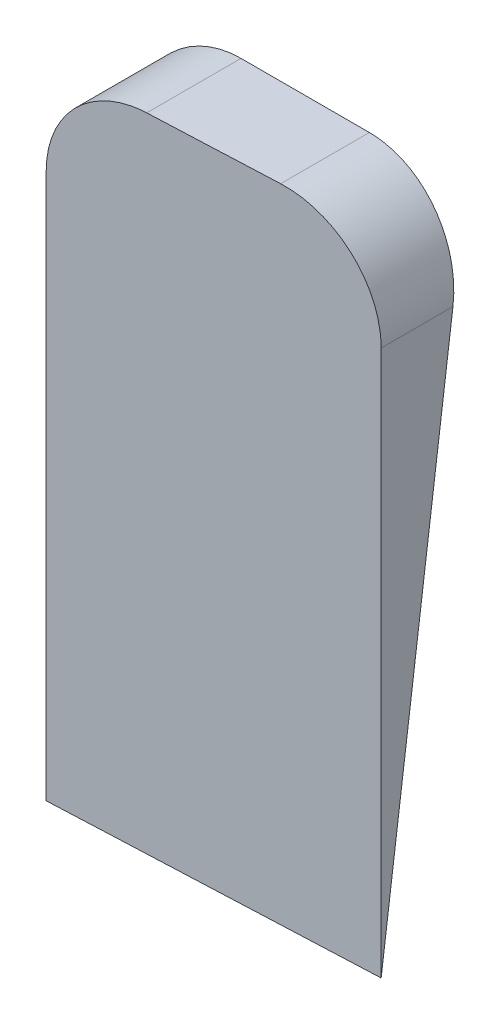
SolidWorks part; units mm, degrees
ref_plane "Ebene vorne" through (0, 0, 0) normal (0, 0, 1) x (1, 0, 0)
ref_plane "Ebene oben" through (0, 0, 0) normal (0, 1, 0) x (1, 0, 0)
ref_plane "Ebene rechts" through (0, 0, 0) normal (1, 0, 0) x (0, 0, -1)
sketch "Skizze1" plane through (0, 0, 0) normal (0, 0, 1) x (1, 0, 0)
  line L1 (0, 0) -> (10, 0)
  line L2 (0, 0) -> (0, 17)
  line L3 (3, 20) -> (7, 20)
  line L4 (10, 0) -> (10, 17)
  arc A0 (0, 17) -> (3, 20) centre (3, 17) cw
  arc A1 (10, 17) -> (7, 20) centre (7, 17) ccw
  point P7 (0, 20)
  dimension "D3" = 3
  dimension "D1" = 10
  dimension "D2" = 20
extrude "Linear austragen1" add sketch "Skizze1" along normal blind 25
sketch "Skizze2" plane through (0, 0, 0) normal (-1, 0, 0) x (0, 0, 1)
  line L0 (0, 20) -> (2.633, 0)
  line L1 (25, 0) -> (0, 0) construction
  line L2 (2.633, 0) -> (0, 0)
  line L3 (0, 0) -> (0, 20)
  dimension "D1" = 7.5
extrude "Schnitt-Linear austragen1" cut sketch "Skizze2" against normal through all
sketch "Skizze3" plane through (0, 0, 0) normal (0, -1, 0) x (1, 0, 0)
  line L0 (10, 2.633) -> (0, 2.633) construction
  line L1 (10, 25) -> (10, 2.633) construction
  line L2 (10, 2.633) -> (10, 25)
  line L3 (10, 25) -> (0, 25)
  line L4 (0, 25) -> (0, 3.0697)
  line L6 (0, 3.0697) -> (10, 2.633)
  dimension "D1" = 2.5
extrude "Schnitt-Linear austragen2" cut sketch "Skizze3" against normal through all
